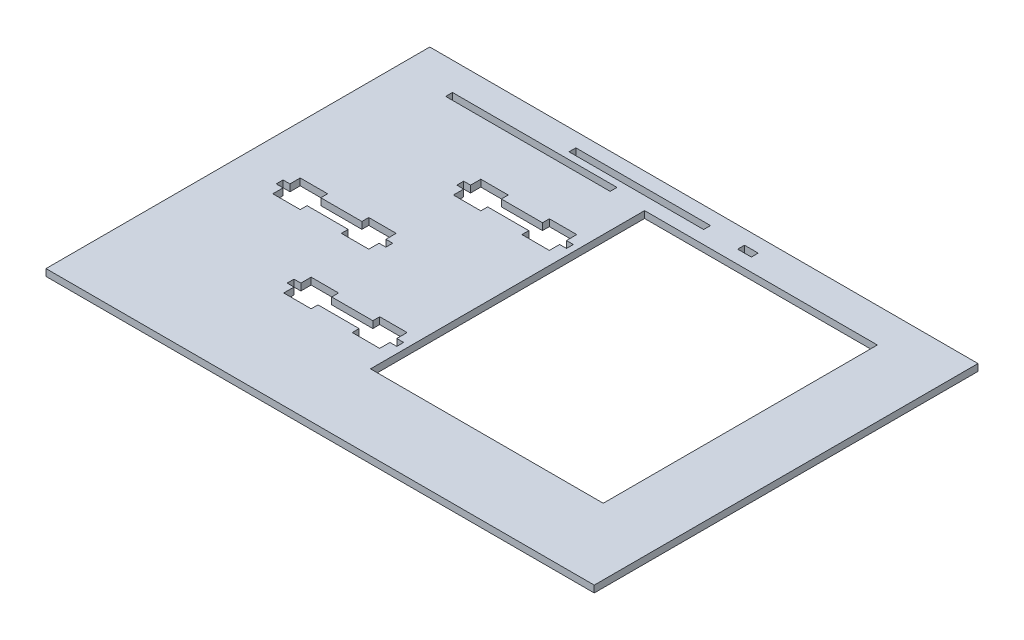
SolidWorks part; units mm, degrees
ref_plane "Front Plane" through (0, 0, 0) normal (0, 0, 1) x (1, 0, 0)
ref_plane "Top Plane" through (0, 0, 0) normal (0, 1, 0) x (1, 0, 0)
ref_plane "Right Plane" through (0, 0, 0) normal (1, 0, 0) x (0, 0, -1)
sketch "Sketch1" plane through (0, 0, 0) normal (0, 1, 0) x (1, 0, 0)
  line L0 (42.3291, 0) -> (127, 0) construction
  line L1 (-127, -88.9) -> (127, -88.9)
  line L2 (-127, -88.9) -> (-127, 88.9)
  line L3 (-127, 88.9) -> (127, 88.9)
  line L4 (127, -88.9) -> (127, 88.9)
  line L5 (-127, -88.9) -> (127, 88.9) construction
  line L6 (-127, 88.9) -> (127, -88.9) construction
  circle A0 centre (42.3291, 0) radius 3.175
  point P0 (0, 0)
  dimension "D1" = 254
  dimension "D2" = 177.8
extrude "Boss-Extrude1" add sketch "Sketch1" along normal blind 3.175
sketch "Sketch2" plane through (0, 3.175, 0) normal (0, 1, 0) x (1, 0, 0)
  line L0 (-103.499, 75.9353) -> (-27.299, 75.9353)
  line L1 (-103.499, 72.7603) -> (-27.299, 72.7603)
  line L5 (25.4344, 79.1103) -> (31.7844, 79.1103)
  line L6 (-103.499, 75.9353) -> (-103.499, 72.7603)
  line L7 (25.4344, 79.1103) -> (25.4344, 82.2853)
  line L8 (-27.299, 75.9353) -> (-27.299, 72.7603)
  line L9 (25.4344, 82.2853) -> (31.7844, 82.2853)
  line L10 (31.7844, 79.1103) -> (31.7844, 82.2853)
  line L12 (-60.0166, 6.35) -> (-72.7166, 6.35)
  line L13 (-52.699, 79.1103) -> (9.6702, 79.1103)
  line L14 (-52.699, 79.1103) -> (-52.699, 82.2853)
  line L15 (-52.699, 82.2853) -> (9.6702, 82.2853)
  line L16 (9.6702, 79.1103) -> (9.6702, 82.2853)
  line L17 (-60.0166, 3.175) -> (-60.0166, 6.35)
  line L18 (-60.0166, -1.5875) -> (-60.0166, -3.175)
  line L19 (-72.7166, 6.35) -> (-72.7166, 3.175)
  line L20 (-39.9082, 33.5736) -> (-39.9082, -43.6766) construction
  line L21 (-91.7666, 6.35) -> (-91.7666, 3.175)
  line L22 (-104.4666, -1.5875) -> (-104.4666, -3.175)
  line L23 (-104.4666, 6.35) -> (-104.4666, 3.175)
  line L24 (-62.1332, 39.7492) -> (-62.1332, 38.1617)
  line L25 (-56.8416, 1.5875) -> (-60.0166, 1.5875)
  line L26 (-56.8416, 1.5875) -> (-56.8416, -1.5875)
  line L27 (-56.8416, -1.5875) -> (-60.0166, -1.5875)
  line L28 (-17.6832, 39.7492) -> (-17.6832, 38.1617)
  line L29 (-104.4666, 1.5875) -> (-107.6416, 1.5875)
  line L31 (-104.4666, -1.5875) -> (-107.6416, -1.5875)
  line L32 (-107.6416, 1.5875) -> (-107.6416, -1.5875)
  line L33 (-60.0166, -3.175) -> (-60.0166, -6.35)
  line L34 (-60.0166, -6.35) -> (-72.7166, -6.35)
  line L35 (-72.7166, -3.175) -> (-72.7166, -6.35)
  line L37 (-91.7666, -3.175) -> (-91.7666, -6.35)
  line L38 (-65.3082, 42.9242) -> (-65.3082, 39.7492)
  line L39 (-104.4666, -3.175) -> (-104.4666, -6.35)
  line L40 (-91.7666, -6.35) -> (-104.4666, -6.35)
  line L41 (-91.7666, 6.35) -> (-104.4666, 6.35)
  line L43 (-17.6832, 44.5117) -> (-17.6832, 47.6867)
  line L44 (-14.5082, 42.9242) -> (-17.6832, 42.9242)
  line L45 (-62.1332, 39.7492) -> (-65.3082, 39.7492)
  line L46 (-49.4332, 44.5117) -> (-30.3832, 44.5117)
  line L47 (-49.4332, 34.9867) -> (-62.1332, 34.9867)
  line L48 (-107.6416, 6.35) -> (-56.8416, -6.35) construction
  line L49 (-62.1332, 44.5117) -> (-62.1332, 42.9242)
  line L50 (-49.4332, 38.1617) -> (-30.3832, 38.1617)
  line L51 (-17.6832, 44.5117) -> (-17.6832, 42.9242)
  line L52 (-91.7666, 3.175) -> (-72.7166, 3.175)
  line L53 (-107.6416, -6.35) -> (-56.8416, 6.35) construction
  line L54 (-82.2416, 24.0304) -> (-82.2416, -37.272) construction
  line L56 (-62.1332, 42.9242) -> (-65.3082, 42.9242)
  line L57 (-49.4332, 47.6867) -> (-62.1332, 47.6867)
  line L58 (-14.5082, 42.9242) -> (-14.5082, 39.7492)
  line L59 (-17.6832, 34.9867) -> (-30.3832, 34.9867)
  line L60 (-17.6832, 47.6867) -> (-30.3832, 47.6867)
  line L61 (-62.1332, 47.6867) -> (-62.1332, 44.5117)
  line L62 (-104.4666, 3.175) -> (-104.4666, 1.5875)
  line L63 (-49.4332, 47.6867) -> (-49.4332, 44.5117)
  line L64 (-49.4332, 38.1617) -> (-49.4332, 34.9867)
  line L65 (-30.3832, 47.6867) -> (-30.3832, 44.5117)
  line L66 (-65.3082, 34.9867) -> (-14.5082, 47.6867) construction
  line L67 (-30.3832, 38.1617) -> (-30.3832, 34.9867)
  line L68 (-14.5082, 39.7492) -> (-17.6832, 39.7492)
  line L69 (-11.5899, 73.025) -> (96.2481, 73.025)
  line L70 (-11.5899, 73.025) -> (-11.5899, -53.975)
  line L71 (-11.5899, -53.975) -> (96.2481, -53.975)
  line L72 (-91.7666, -3.175) -> (-72.7166, -3.175)
  line L73 (-62.1332, 38.1617) -> (-62.1332, 34.9867)
  line L74 (-65.3082, 47.6867) -> (-14.5082, 34.9867) construction
  line L75 (96.2481, 73.025) -> (96.2481, -53.975)
  line L77 (-17.6832, 38.1617) -> (-17.6832, 34.9867)
  line L78 (-65.3082, -30.922) -> (-62.1332, -31.7158) construction
  line L79 (-65.3082, -35.6845) -> (-65.3082, -38.8595)
  line L80 (-62.1332, -35.6845) -> (-65.3082, -35.6845)
  line L82 (-49.4332, -30.922) -> (-49.4332, -34.097)
  line L84 (-60.0166, 3.175) -> (-60.0166, 1.5875)
  line L85 (-17.6832, -30.922) -> (-30.3832, -30.922)
  line L86 (-30.3832, -40.447) -> (-30.3832, -43.622)
  line L87 (-65.3082, -43.622) -> (-52.6082, -40.447) construction
  line L88 (-49.4332, -30.922) -> (-62.1332, -30.922)
  line L90 (-49.4332, -34.097) -> (-30.3832, -34.097)
  line L91 (-49.4332, -43.622) -> (-62.1332, -43.622)
  line L92 (-62.1332, -34.097) -> (-62.1332, -35.6845)
  line L93 (-62.1332, -38.8595) -> (-65.3082, -38.8595)
  line L94 (-62.1332, -40.447) -> (-62.1332, -43.622)
  line L95 (-14.5082, -35.6845) -> (-17.6832, -35.6845)
  line L96 (-30.3832, -30.922) -> (-30.3832, -34.097)
  line L97 (-17.6832, -40.447) -> (-17.6832, -43.622)
  line L98 (-14.5082, -35.6845) -> (-14.5082, -38.8595)
  line L99 (-17.6832, -31.7158) -> (-14.5082, -30.922) construction
  line L100 (-17.6832, -34.097) -> (-17.6832, -30.922)
  line L102 (-62.1332, -30.922) -> (-62.1332, -34.097)
  line L103 (-49.4332, -40.447) -> (-30.3832, -40.447)
  line L104 (-49.4332, -40.447) -> (-49.4332, -43.622)
  line L105 (-27.2082, -40.447) -> (-14.5082, -43.622) construction
  line L106 (-17.6832, -43.622) -> (-30.3832, -43.622)
  line L107 (-14.5082, -38.8595) -> (-17.6832, -38.8595)
  line L108 (-17.6832, -34.097) -> (-17.6832, -35.6845)
  line L109 (-62.1332, -38.8595) -> (-62.1332, -40.447)
  line L110 (-17.6832, -38.8595) -> (-17.6832, -40.447)
extrude "Cut-Extrude1" cut sketch "Sketch2" against normal through all
